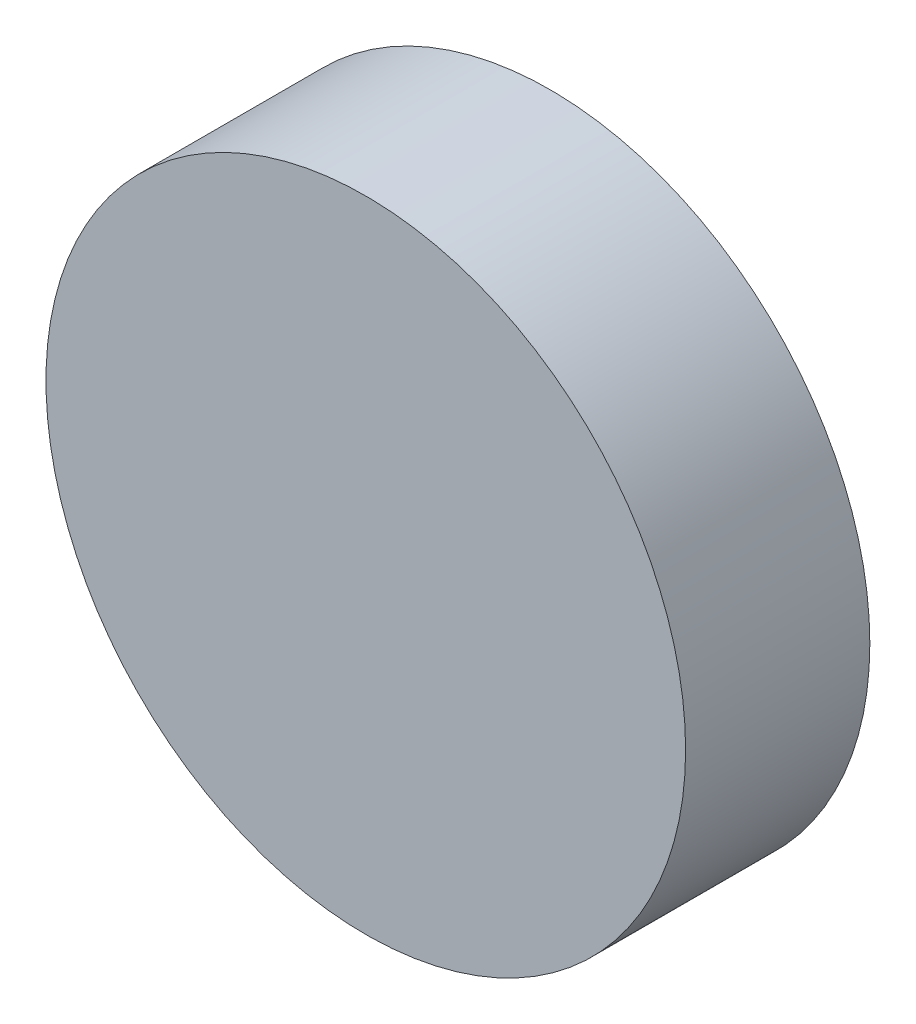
SolidWorks part; units mm, degrees
ref_plane "Front Plane" through (0, 0, 0) normal (0, 0, 1) x (1, 0, 0)
ref_plane "Top Plane" through (0, 0, 0) normal (0, 1, 0) x (1, 0, 0)
ref_plane "Right Plane" through (0, 0, 0) normal (1, 0, 0) x (0, 0, -1)
sketch "Sketch1" plane through (0, 0, 0) normal (0, 0, 1) x (1, 0, 0)
  circle A0 centre (0, 0) radius 17.3605
extrude "Boss-Extrude1" add sketch "Sketch1" along normal blind 10
